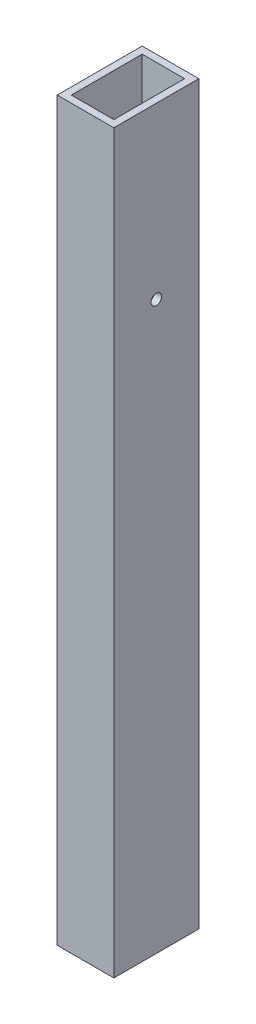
SolidWorks part; units mm, degrees
ref_plane "Front Plane" through (0, 0, 0) normal (0, 0, 1) x (1, 0, 0)
ref_plane "Top Plane" through (0, 0, 0) normal (0, 1, 0) x (1, 0, 0)
ref_plane "Right Plane" through (0, 0, 0) normal (1, 0, 0) x (0, 0, -1)
sketch "Sketch1" plane through (0, 0, 0) normal (0, 1, 0) x (1, 0, 0)
  line L0 (-19.05, -31.75) -> (-19.05, 31.75)
  line L1 (-25.4, -38.1) -> (25.4, -38.1)
  line L2 (-25.4, -38.1) -> (-25.4, 38.1)
  line L3 (-25.4, 38.1) -> (25.4, 38.1)
  line L4 (25.4, -38.1) -> (25.4, 38.1)
  line L5 (-19.05, 31.75) -> (19.05, 31.75)
  line L6 (19.05, -31.75) -> (19.05, 31.75)
  line L7 (-19.05, -31.75) -> (19.05, -31.75)
  dimension "D1" = 50.8
  dimension "D2" = 25.4
  dimension "D3" = 38.1
  dimension "D4" = 76.2
  dimension "D5" = 6.35
extrude "Extrude1" add sketch "Sketch1" against normal blind 660.4
sketch "Sketch2" plane through (25.4, 0, 0) normal (1, 0, 0) x (0, 0, -1)
  circle A0 centre (0, -152.4) radius 4.7625
  dimension "D1" = 9.525
  dimension "D2" = 152.4
extrude "Cut-Extrude1" cut sketch "Sketch2" against normal blind 457.2
